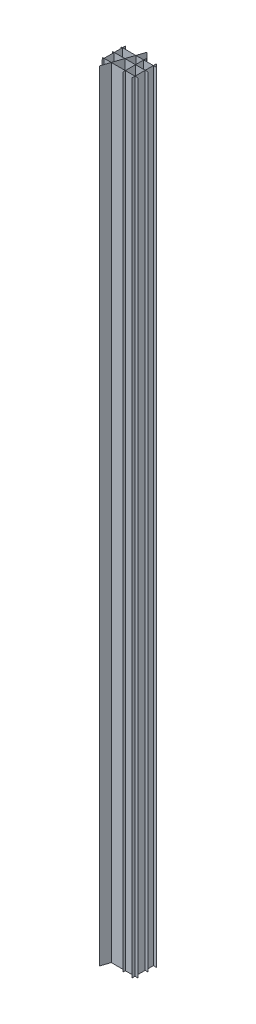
SolidWorks part; units mm, degrees
other "DetailItem28"
other "DetailItem29"
other "DetailItem30"
other "DetailItem31"
other "DetailItem32"
other "DetailItem33"
other "Grid System1" parameters "D1"=5283.2, "D2"=5283.2, "D3"=0, "D4"=0
sketch "Sketch1" plane through (0, 0, 0) normal (0, 1, 0) x (1, 0, 0)
  line L0 (-91.1914, -67.2343) -> (-91.1914, 91.9642)
  line L1 (53.0662, -67.2343) -> (53.0662, 91.9642)
  line L2 (118.4973, -70.8408) -> (118.4973, 91.9642)
  line L3 (-101.4955, 72.3864) -> (138.5903, 72.3864)
  line L4 (-101.4955, 16.7442) -> (138.5903, 16.7442)
  line L5 (-101.4955, -52.2934) -> (138.5903, -52.2934)
  line L6 (-61.9071, -111.202) -> (18.5474, 129.1724)
  point P14 (-91.1914, 72.3864)
  point P15 (-91.1914, 16.7442)
  point P16 (-91.1914, -52.2934)
  point P17 (53.0662, 72.3864)
  point P18 (53.0662, 16.7442)
  point P19 (53.0662, -52.2934)
  point P20 (118.4973, 72.3864)
  point P21 (118.4973, 16.7442)
  point P22 (118.4973, -52.2934)
  point P23 (-0.4591, 72.3864)
  point P24 (-19.0829, 16.7442)
  point P25 (-42.1901, -52.2934)
ref_plane "Level1" through (0, 1371.6, 0) normal (0, 1, 0) x (1, 0, 0)
sketch "Sketch2" plane through (0, 1371.6, 0) normal (0, 1, 0) x (1, 0, 0)
  line L0 (-91.1914, -67.2343) -> (-91.1914, 91.9642)
  line L1 (53.0662, -67.2343) -> (53.0662, 91.9642)
  line L2 (118.4973, -70.8408) -> (118.4973, 91.9642)
  line L3 (-101.4955, 72.3864) -> (138.5903, 72.3864)
  line L4 (-101.4955, 16.7442) -> (138.5903, 16.7442)
  line L5 (-101.4955, -52.2934) -> (138.5903, -52.2934)
  line L6 (-61.9071, -111.202) -> (18.5474, 129.1724)
  point P14 (-91.1914, 72.3864)
  point P15 (-91.1914, 16.7442)
  point P16 (-91.1914, -52.2934)
  point P17 (53.0662, 72.3864)
  point P18 (53.0662, 16.7442)
  point P19 (53.0662, -52.2934)
  point P20 (118.4973, 72.3864)
  point P21 (118.4973, 16.7442)
  point P22 (118.4973, -52.2934)
  point P23 (-0.4591, 72.3864)
  point P24 (-19.0829, 16.7442)
  point P25 (-42.1901, -52.2934)
ref_plane "Level2" through (0, 3098.8, 0) normal (0, 1, 0) x (1, 0, 0)
sketch "Sketch3" plane through (0, 3098.8, 0) normal (0, 1, 0) x (1, 0, 0)
  line L0 (-91.1914, -67.2343) -> (-91.1914, 91.9642)
  line L1 (53.0662, -67.2343) -> (53.0662, 91.9642)
  line L2 (118.4973, -70.8408) -> (118.4973, 91.9642)
  line L3 (-101.4955, 72.3864) -> (138.5903, 72.3864)
  line L4 (-101.4955, 16.7442) -> (138.5903, 16.7442)
  line L5 (-101.4955, -52.2934) -> (138.5903, -52.2934)
  line L6 (-61.9071, -111.202) -> (18.5474, 129.1724)
  point P14 (-91.1914, 72.3864)
  point P15 (-91.1914, 16.7442)
  point P16 (-91.1914, -52.2934)
  point P17 (53.0662, 72.3864)
  point P18 (53.0662, 16.7442)
  point P19 (53.0662, -52.2934)
  point P20 (118.4973, 72.3864)
  point P21 (118.4973, 16.7442)
  point P22 (118.4973, -52.2934)
  point P23 (-0.4591, 72.3864)
  point P24 (-19.0829, 16.7442)
  point P25 (-42.1901, -52.2934)
ref_plane "Level3" through (0, 3911.6, 0) normal (0, 1, 0) x (1, 0, 0)
sketch "Sketch4" plane through (0, 3911.6, 0) normal (0, 1, 0) x (1, 0, 0)
  line L0 (-91.1914, -67.2343) -> (-91.1914, 91.9642)
  line L1 (53.0662, -67.2343) -> (53.0662, 91.9642)
  line L2 (118.4973, -70.8408) -> (118.4973, 91.9642)
  line L3 (-101.4955, 72.3864) -> (138.5903, 72.3864)
  line L4 (-101.4955, 16.7442) -> (138.5903, 16.7442)
  line L5 (-101.4955, -52.2934) -> (138.5903, -52.2934)
  line L6 (-61.9071, -111.202) -> (18.5474, 129.1724)
  point P14 (-91.1914, 72.3864)
  point P15 (-91.1914, 16.7442)
  point P16 (-91.1914, -52.2934)
  point P17 (53.0662, 72.3864)
  point P18 (53.0662, 16.7442)
  point P19 (53.0662, -52.2934)
  point P20 (118.4973, 72.3864)
  point P21 (118.4973, 16.7442)
  point P22 (118.4973, -52.2934)
  point P23 (-0.4591, 72.3864)
  point P24 (-19.0829, 16.7442)
  point P25 (-42.1901, -52.2934)
ref_plane "Level4" through (0, 5283.2, 0) normal (0, 1, 0) x (1, 0, 0)
sketch "Sketch5" plane through (0, 5283.2, 0) normal (0, 1, 0) x (1, 0, 0)
  line L0 (-91.1914, -67.2343) -> (-91.1914, 91.9642)
  line L1 (53.0662, -67.2343) -> (53.0662, 91.9642)
  line L2 (118.4973, -70.8408) -> (118.4973, 91.9642)
  line L3 (-101.4955, 72.3864) -> (138.5903, 72.3864)
  line L4 (-101.4955, 16.7442) -> (138.5903, 16.7442)
  line L5 (-101.4955, -52.2934) -> (138.5903, -52.2934)
  line L6 (-61.9071, -111.202) -> (18.5474, 129.1724)
  point P14 (-91.1914, 72.3864)
  point P15 (-91.1914, 16.7442)
  point P16 (-91.1914, -52.2934)
  point P17 (53.0662, 72.3864)
  point P18 (53.0662, 16.7442)
  point P19 (53.0662, -52.2934)
  point P20 (118.4973, 72.3864)
  point P21 (118.4973, 16.7442)
  point P22 (118.4973, -52.2934)
  point P23 (-0.4591, 72.3864)
  point P24 (-19.0829, 16.7442)
  point P25 (-42.1901, -52.2934)
sketch3d "3DSketch1"
  line L0 (-91.1914, 0, -72.3864) -> (-91.1914, 1371.6, -72.3864)
  line L1 (-91.1914, 1371.6, -72.3864) -> (-91.1914, 3098.8, -72.3864)
  line L2 (-91.1914, 3098.8, -72.3864) -> (-91.1914, 3911.6, -72.3864)
  line L3 (-91.1914, 3911.6, -72.3864) -> (-91.1914, 5283.2, -72.3864)
  line L4 (-91.1914, 0, -16.7442) -> (-91.1914, 1371.6, -16.7442)
  line L5 (-91.1914, 1371.6, -16.7442) -> (-91.1914, 3098.8, -16.7442)
  line L6 (-91.1914, 3098.8, -16.7442) -> (-91.1914, 3911.6, -16.7442)
  line L7 (-91.1914, 3911.6, -16.7442) -> (-91.1914, 5283.2, -16.7442)
  line L8 (-91.1914, 0, 52.2934) -> (-91.1914, 1371.6, 52.2934)
  line L9 (-91.1914, 1371.6, 52.2934) -> (-91.1914, 3098.8, 52.2934)
  line L10 (-91.1914, 3098.8, 52.2934) -> (-91.1914, 3911.6, 52.2934)
  line L11 (-91.1914, 3911.6, 52.2934) -> (-91.1914, 5283.2, 52.2934)
  line L12 (53.0662, 0, -72.3864) -> (53.0662, 1371.6, -72.3864)
  line L13 (53.0662, 1371.6, -72.3864) -> (53.0662, 3098.8, -72.3864)
  line L14 (53.0662, 3098.8, -72.3864) -> (53.0662, 3911.6, -72.3864)
  line L15 (53.0662, 3911.6, -72.3864) -> (53.0662, 5283.2, -72.3864)
  line L16 (53.0662, 0, -16.7442) -> (53.0662, 1371.6, -16.7442)
  line L17 (53.0662, 1371.6, -16.7442) -> (53.0662, 3098.8, -16.7442)
  line L18 (53.0662, 3098.8, -16.7442) -> (53.0662, 3911.6, -16.7442)
  line L19 (53.0662, 3911.6, -16.7442) -> (53.0662, 5283.2, -16.7442)
  line L20 (53.0662, 0, 52.2934) -> (53.0662, 1371.6, 52.2934)
  line L21 (53.0662, 1371.6, 52.2934) -> (53.0662, 3098.8, 52.2934)
  line L22 (53.0662, 3098.8, 52.2934) -> (53.0662, 3911.6, 52.2934)
  line L23 (53.0662, 3911.6, 52.2934) -> (53.0662, 5283.2, 52.2934)
  line L24 (118.4973, 0, -72.3864) -> (118.4973, 1371.6, -72.3864)
  line L25 (118.4973, 1371.6, -72.3864) -> (118.4973, 3098.8, -72.3864)
  line L26 (118.4973, 3098.8, -72.3864) -> (118.4973, 3911.6, -72.3864)
  line L27 (118.4973, 3911.6, -72.3864) -> (118.4973, 5283.2, -72.3864)
  line L28 (118.4973, 0, -16.7442) -> (118.4973, 1371.6, -16.7442)
  line L29 (118.4973, 1371.6, -16.7442) -> (118.4973, 3098.8, -16.7442)
  line L30 (118.4973, 3098.8, -16.7442) -> (118.4973, 3911.6, -16.7442)
  line L31 (118.4973, 3911.6, -16.7442) -> (118.4973, 5283.2, -16.7442)
  line L32 (118.4973, 0, 52.2934) -> (118.4973, 1371.6, 52.2934)
  line L33 (118.4973, 1371.6, 52.2934) -> (118.4973, 3098.8, 52.2934)
  line L34 (118.4973, 3098.8, 52.2934) -> (118.4973, 3911.6, 52.2934)
  line L35 (118.4973, 3911.6, 52.2934) -> (118.4973, 5283.2, 52.2934)
  line L36 (-0.4591, 0, -72.3864) -> (-0.4591, 1371.6, -72.3864)
  line L37 (-0.4591, 1371.6, -72.3864) -> (-0.4591, 3098.8, -72.3864)
  line L38 (-0.4591, 3098.8, -72.3864) -> (-0.4591, 3911.6, -72.3864)
  line L39 (-0.4591, 3911.6, -72.3864) -> (-0.4591, 5283.2, -72.3864)
  line L40 (-19.0829, 0, -16.7442) -> (-19.0829, 1371.6, -16.7442)
  line L41 (-19.0829, 1371.6, -16.7442) -> (-19.0829, 3098.8, -16.7442)
  line L42 (-19.0829, 3098.8, -16.7442) -> (-19.0829, 3911.6, -16.7442)
  line L43 (-19.0829, 3911.6, -16.7442) -> (-19.0829, 5283.2, -16.7442)
  line L44 (-42.1901, 0, 52.2934) -> (-42.1901, 1371.6, 52.2934)
  line L45 (-42.1901, 1371.6, 52.2934) -> (-42.1901, 3098.8, 52.2934)
  line L46 (-42.1901, 3098.8, 52.2934) -> (-42.1901, 3911.6, 52.2934)
  line L47 (-42.1901, 3911.6, 52.2934) -> (-42.1901, 5283.2, 52.2934)
surface "Surface-Extrude1" sketch "Sketch1"
ref_plane "Front Plane" through (0, 0, 0) normal (0, 0, 1) x (1, 0, 0)
ref_plane "Top Plane" through (0, 0, 0) normal (0, 1, 0) x (1, 0, 0)
ref_plane "Right Plane" through (0, 0, 0) normal (1, 0, 0) x (0, 0, -1)
